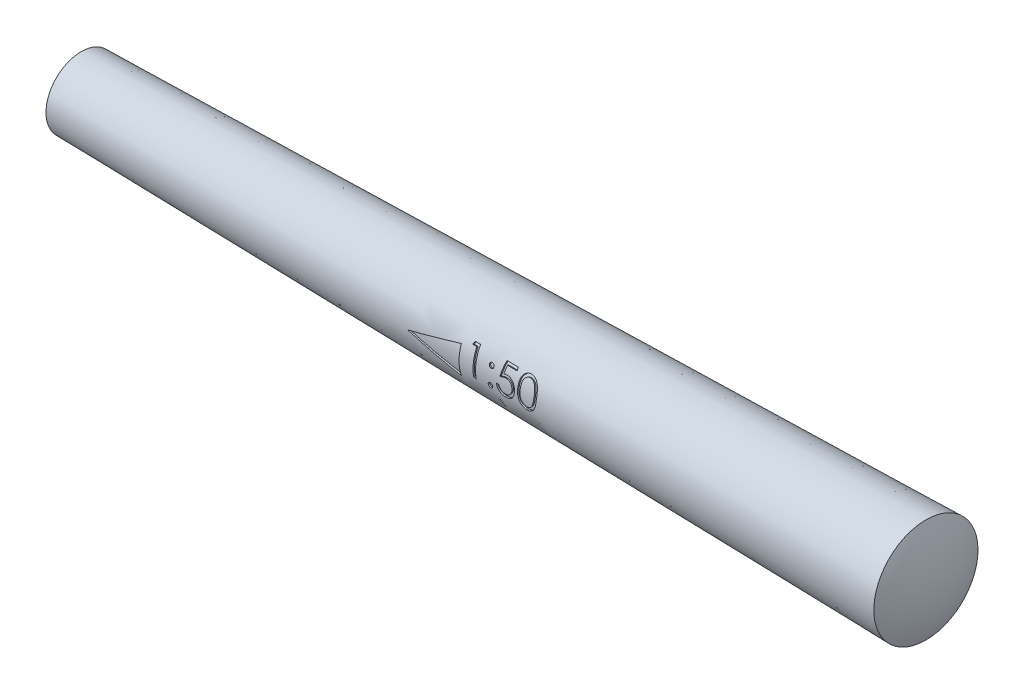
SolidWorks part; units mm, degrees
ref_plane "Front Plane" through (0, 0, 0) normal (0, 0, 1) x (1, 0, 0)
ref_plane "Top Plane" through (0, 0, 0) normal (0, 1, 0) x (1, 0, 0)
ref_plane "Right Plane" through (0, 0, 0) normal (1, 0, 0) x (0, 0, -1)
sketch "Sketch1" plane through (0, 0, 0) normal (1, 0, 0) x (0, 0, -1)
  circle A0 centre (0, 0) radius 1.25
  dimension "D1" = 2.5
extrude "Extrude1" add sketch "Sketch1" along normal mid plane 30
draft "Draft1" type of draft neutral plane draft angle 1.146 faces to draft 1 parameters "D1"=1.146
sketch "Sketch2" plane through (0, 0, 0) normal (0, 0, 1) x (1, 0, 0)
  line L0 (-15, 0) -> (-15, 1.25)
  line L1 (-15, 1.25) -> (-15, -1.25) construction
  line L2 (-15, 0) -> (-15.4, 0)
  line L3 (-15.4, 0) -> (-15.4, -1.55) construction
  line L4 (15, 0) -> (15, 1.85)
  line L5 (15, -1.85) -> (15, 1.85) construction
  line L6 (15, 0) -> (15.4, 0)
  line L7 (15.4, 0) -> (15.4, -1.55) construction
  line L8 (-15, -1.25) -> (15, -1.85) construction
  arc A0 (-15.4, 0) -> (-15, 1.25) centre (-13.2469, 0) cw
  arc A1 (15.4, 0) -> (15, 1.85) centre (10.9218, 0) ccw
  point P14 (0, -1.55)
revolve "Revolve1" add sketch "Sketch2" angle 360 about L2
sketch "Sketch5" plane through (0, 0, 0) normal (0, 0, 1) x (1, 0, 0)
  line L0 (0, 1.55) -> (0, -1.55) construction
  line L1 (15, 1.85) -> (-15, 1.25) construction
  line L2 (-15, -1.25) -> (15, -1.85) construction
ref_plane "Plane2" through (0, 0, 0) normal (-0.02, 0, 0.9998) x (0.9998, 0, 0.02)
sketch "Sketch6" plane through (0, 0, 0) normal (-0.02, 0, 0.9998) x (0.9998, 0, 0.02)
  line L0 (0, 0) -> (0, 0.5)
  line L1 (0, 1.55) -> (0, -1.55) construction
  line L2 (0, 0.5) -> (-1.866, 0)
  line L3 (-1.866, 0) -> (0, -0.5)
  line L4 (0, -0.5) -> (0, 0)
  line L5 (0, -0.25) -> (3, -0.25) construction
  text T0 "1:50" font "Century Gothic" height 1
  dimension "D1" = 1
  dimension "D2" = 30
  dimension "D3" = 3
wrap "Wrap2" sketch "Sketch6" wrap type deboss source sketch "Sketch6" thickness 0.05 parameters "D1"=0.05
equation "\"D2@Sketch2\" = \"D1@Sketch2\""
